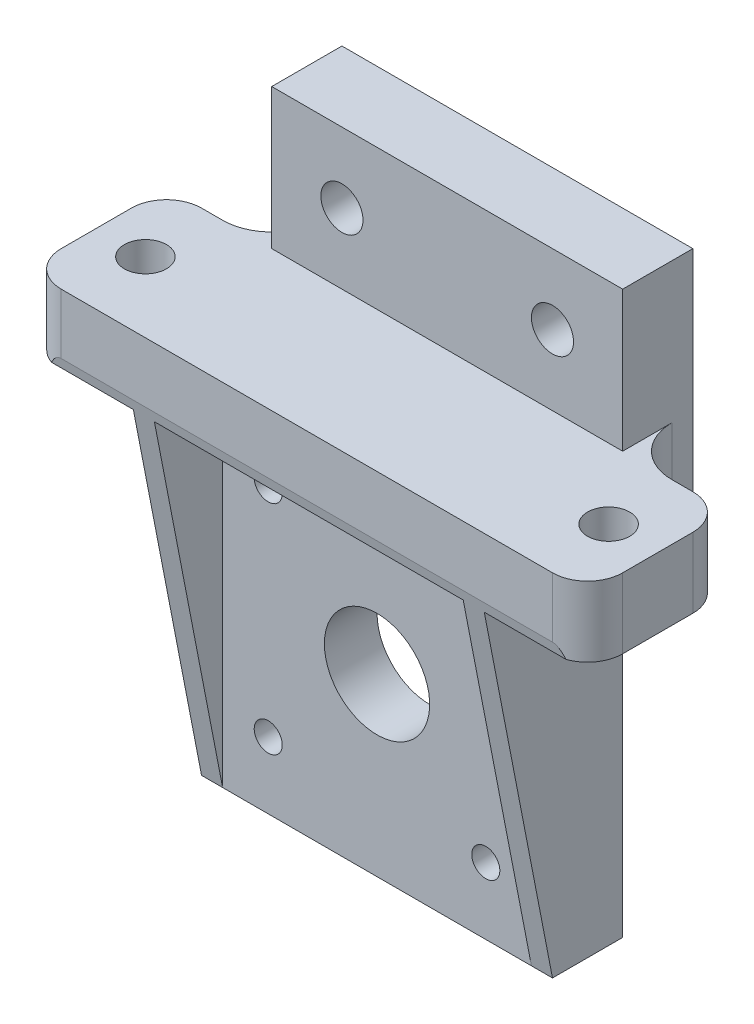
SolidWorks part; units mm, degrees
ref_plane "Plan de face" through (0, 0, 0) normal (0, 0, 1) x (1, 0, 0)
ref_plane "Plan de dessus" through (0, 0, 0) normal (0, 1, 0) x (1, 0, 0)
ref_plane "Plan de droite" through (0, 0, 0) normal (1, 0, 0) x (0, 0, -1)
sketch "Esquisse1" plane through (0, 0, 0) normal (0, 0, 1) x (1, 0, 0)
  line L1 (-61.7763, 28.0351) -> (-11.7763, 28.0351)
  line L2 (-61.7763, 28.0351) -> (-61.7763, -21.9649)
  line L3 (-61.7763, -21.9649) -> (-11.7763, -21.9649)
  line L4 (-11.7763, 28.0351) -> (-11.7763, -21.9649)
  dimension "D1" = 50
  dimension "D2" = 50
extrude "Boss.-Extru.1" add sketch "Esquisse1" along normal blind 10
sketch "Esquisse2" plane through (0, 0, 0) normal (0, 0, -1) x (-1, 0, 0)
  circle A0 centre (36.7763, 3.0351) radius 11.125
  dimension "D1" = 22.25
extrude "Enlèv. mat.-Extru.1" cut sketch "Esquisse2" against normal blind 2.5
sketch "Esquisse3" plane through (0, 0, 2.5) normal (0, 0, -1) x (-1, 0, 0)
  circle A0 centre (36.7763, 3.0351) radius 7.5
extrude "Enlèv. mat.-Extru.2" cut sketch "Esquisse3" against normal through all
sketch "Esquisse4" plane through (0, 0, 0) normal (0, 0, -1) x (-1, 0, 0)
  circle A0 centre (52.2763, -12.4649) radius 2
  circle A1 centre (21.2763, -12.4649) radius 2
  circle A2 centre (21.2763, 18.5351) radius 2
  circle A3 centre (52.2763, 18.5351) radius 2
  circle A4 centre (36.7763, 3.0351) radius 11.125 construction
  circle A5 centre (36.7763, 3.0351) radius 11.125 construction
  dimension "D1" = 4
  dimension "D2" = 4
  dimension "D3" = 4
  dimension "D4" = 4
  dimension "D5" = 15.5
  dimension "D6" = 15.5
  dimension "D7" = 15.5
  dimension "D8" = 15.5
  dimension "D9" = 15.5
  dimension "D10" = 15.5
  dimension "D11" = 15.5
  dimension "D12" = 15.5
  dimension "D15" = 31
  dimension "D16" = 31
  dimension "D13" = 31
  dimension "D14" = 31
extrude "Enlèv. mat.-Extru.3" cut sketch "Esquisse4" against normal through all
sketch "Esquisse5" plane through (0, 28.0351, 0) normal (0, 1, 0) x (1, 0, 0)
  line L0 (-11.7763, -10) -> (-11.7763, 0) construction
  line L1 (-11.7763, -20) -> (-61.7763, -20)
  line L2 (-11.7763, -20) -> (-11.7763, 10)
  line L3 (-11.7763, 10) -> (-61.7763, 10)
  line L4 (-61.7763, -20) -> (-61.7763, 10)
  line L5 (-61.7763, -10) -> (-61.7763, 0) construction
  line L6 (-11.7763, -10) -> (-61.7763, -10) construction
  line L7 (-11.7763, 0) -> (-61.7763, 0) construction
  point P4 (-11.7763, -5)
  dimension "D1" = 0
  dimension "D2" = 0
  dimension "D3" = 10
  dimension "D4" = 10
extrude "Boss.-Extru.8" add sketch "Esquisse5" along normal blind 10
sketch "Esquisse10" plane through (-61.7763, 0, 0) normal (-1, 0, 0) x (0, 0, 1)
  line L1 (20, 38.0351) -> (0, 38.0351)
  line L2 (20, 38.0351) -> (20, 28.0351)
  line L3 (20, 28.0351) -> (0, 28.0351)
  line L4 (0, 38.0351) -> (0, 28.0351)
extrude "Boss.-Extru.9" add sketch "Esquisse10" along normal blind 15
sketch "Esquisse11" plane through (-11.7763, 0, 0) normal (1, 0, 0) x (0, 0, -1)
  line L0 (-20, 38.0351) -> (10, 38.0351) construction
  line L1 (-20, 28.0351) -> (0, 28.0351)
  line L2 (-20, 28.0351) -> (-20, 38.0351)
  line L3 (-20, 38.0351) -> (0, 38.0351)
  line L4 (0, 28.0351) -> (0, 38.0351)
extrude "Boss.-Extru.10" add sketch "Esquisse11" along normal blind 15
fillet "Congé5" radius 5 1 edges at (3.2237, 33.0351, 20)
fillet "Congé6" radius 5 1 edges at (3.2237, 33.0351, 0)
fillet "Congé7" radius 5 1 edges at (-76.7763, 33.0351, 20)
fillet "Congé8" radius 5 1 edges at (-76.7763, 33.0351, 0)
fillet "Congé9" radius 5 1 edges
fillet "Congé10" radius 7 1 edges
fillet "Congé11" radius 7 1 edges
sketch "Esquisse12" plane through (0, 38.0351, 0) normal (0, 1, 0) x (1, 0, 0)
  line L0 (-71.7763, -20) -> (-1.7763, -20) construction
  line L1 (-11.7763, 10) -> (-61.7763, 10)
  line L2 (-11.7763, 10) -> (-11.7763, 0)
  line L3 (-11.7763, 0) -> (-61.7763, 0)
  line L4 (-61.7763, 10) -> (-61.7763, 0)
  dimension "D1" = 0
  dimension "D2" = 20
  dimension "D3" = 10
extrude "Boss.-Extru.11" add sketch "Esquisse12" along normal blind 20
fillet "Congé12" radius 5 2 edges
sketch "Esquisse13" plane through (0, 28.0351, 0) normal (0, -1, 0) x (1, 0, 0)
  line L0 (-71.7763, 20) -> (-1.7763, 20) construction
  line L1 (-76.7763, 5) -> (-76.7763, 15) construction
  line L2 (3.2237, 15) -> (3.2237, 5) construction
  circle A0 centre (-69.7763, 10) radius 4.5
  circle A1 centre (-3.7763, 10) radius 4.5
  dimension "D1" = 10
  dimension "D2" = 10
  dimension "D3" = 9
  dimension "D4" = 9
  dimension "D5" = 7
  dimension "D6" = 7
extrude "Enlèv. mat.-Extru.4" cut sketch "Esquisse13" against normal blind 4
sketch "Esquisse14" plane through (0, 32.0351, 0) normal (0, -1, 0) x (1, 0, 0)
  circle A0 centre (-69.7763, 10) radius 3
  dimension "D1" = 6
extrude "Enlèv. mat.-Extru.5" cut sketch "Esquisse14" against normal through all
sketch "Esquisse15" plane through (0, 32.0351, 0) normal (0, -1, 0) x (1, 0, 0)
  circle A0 centre (-3.7763, 10) radius 3
extrude "Enlèv. mat.-Extru.6" cut sketch "Esquisse15" against normal through all
sketch "Esquisse16" plane through (0, 0, 0) normal (0, 0, 1) x (1, 0, 0)
  line L0 (-11.7763, 58.0351) -> (-61.7763, 58.0351) construction
  line L1 (-61.7763, 58.0351) -> (-61.7763, 28.0351) construction
  line L2 (-11.7763, 58.0351) -> (-11.7763, 28.0351) construction
  circle A0 centre (-51.7763, 48.0351) radius 3
  circle A1 centre (-21.7763, 48.0351) radius 3
  point P8 (-48.5017, 49.6267)
  dimension "D1" = 6
  dimension "D2" = 6
  dimension "D5" = 10
  dimension "D6" = 10
  dimension "D3" = 10
  dimension "D4" = 10
extrude "Enlèv. mat.-Extru.7" cut sketch "Esquisse16" against normal through all
sketch "Esquisse17" plane through (0, 0, -10) normal (0, 0, -1) x (-1, 0, 0)
  circle A0 centre (51.7763, 48.0351) radius 4.5
  circle A1 centre (21.7763, 48.0351) radius 4.5
  dimension "D1" = 9
  dimension "D2" = 9
extrude "Enlèv. mat.-Extru.8" cut sketch "Esquisse17" against normal blind 3
sketch "Esquisse18" plane through (0, 0, 10) normal (0, 0, 1) x (1, 0, 0)
  line L0 (-71.7763, 28.0351) -> (-1.7763, 28.0351) construction
  line L1 (-61.7763, -21.9649) -> (-58.7763, -21.9649)
  line L2 (-61.7763, -21.9649) -> (-61.7763, 28.0351)
  line L3 (-61.7763, 28.0351) -> (-58.7763, 28.0351)
  line L4 (-58.7763, -21.9649) -> (-58.7763, 28.0351)
  dimension "D1" = 0
  dimension "D2" = 3
extrude "Boss.-Extru.12" add sketch "Esquisse18" along normal blind 10
sketch "Esquisse19" plane through (0, 0, 10) normal (0, 0, 1) x (1, 0, 0)
  line L0 (-58.7763, 28.0351) -> (-1.7763, 28.0351) construction
  line L1 (-11.7763, -21.9649) -> (-14.7763, -21.9649)
  line L2 (-11.7763, -21.9649) -> (-11.7763, 28.0351)
  line L3 (-11.7763, 28.0351) -> (-14.7763, 28.0351)
  line L4 (-14.7763, -21.9649) -> (-14.7763, 28.0351)
  dimension "D1" = 0
  dimension "D2" = 3
extrude "Boss.-Extru.13" add sketch "Esquisse19" along normal blind 10
chamfer "Chanfrein1" distance 10 angle 79 1 edges at (-60.2763, -21.9649, 20)
